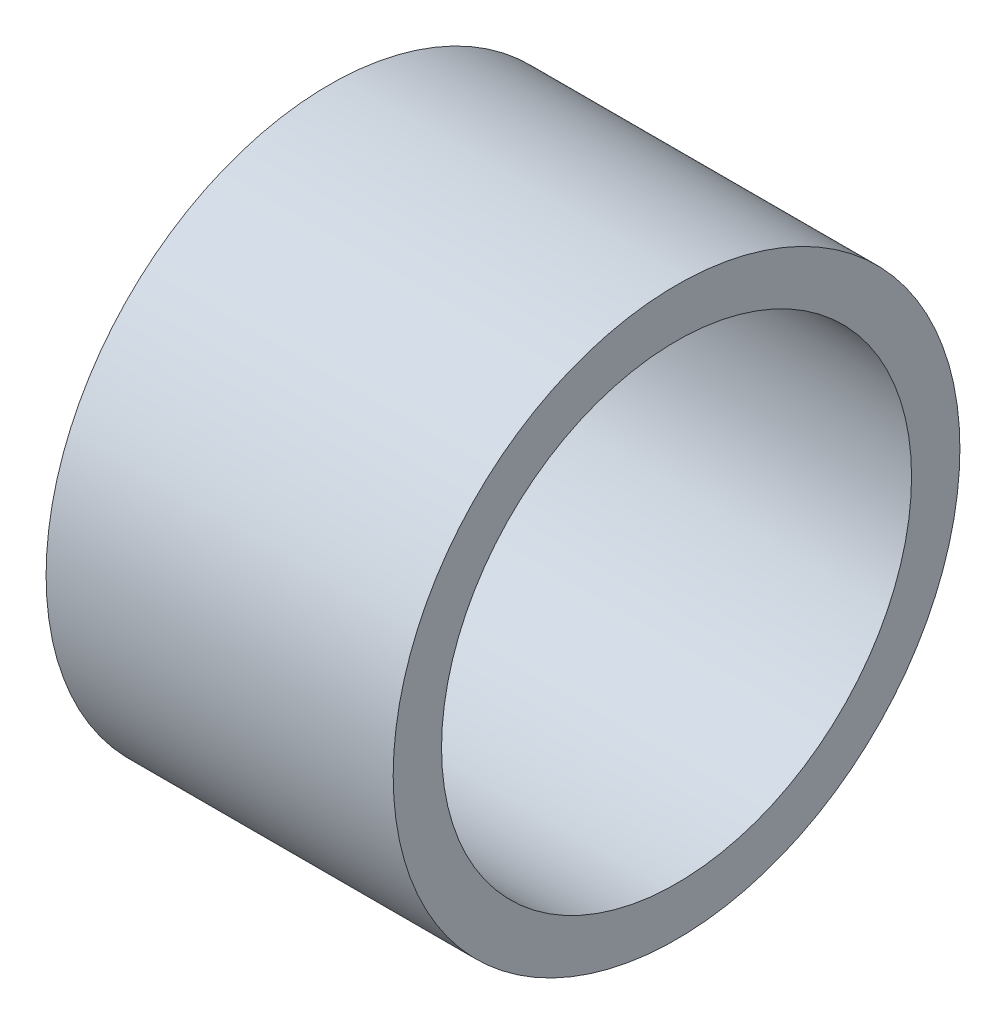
SolidWorks part; units mm, degrees
ref_plane "Plan de face" through (0, 0, 0) normal (0, 0, 1) x (1, 0, 0)
ref_plane "Plan de dessus" through (0, 0, 0) normal (0, 1, 0) x (1, 0, 0)
ref_plane "Plan de droite" through (0, 0, 0) normal (1, 0, 0) x (0, 0, -1)
sketch "Esquisse1" plane through (0, 0, 0) normal (0, 0, 1) x (1, 0, 0)
  line L1 (106.9779, -154.574) -> (82.9779, -154.574)
  line L2 (106.9779, -154.574) -> (106.9779, -151.2304)
  line L3 (106.9779, -151.2304) -> (82.9779, -151.2304)
  line L4 (82.9779, -154.574) -> (82.9779, -151.2304)
  line L5 (54.6897, -170.824) -> (67.2776, -170.824) construction
  dimension "D1" = 24
revolve "Révolution1" add sketch "Esquisse1" angle 360 about L5
